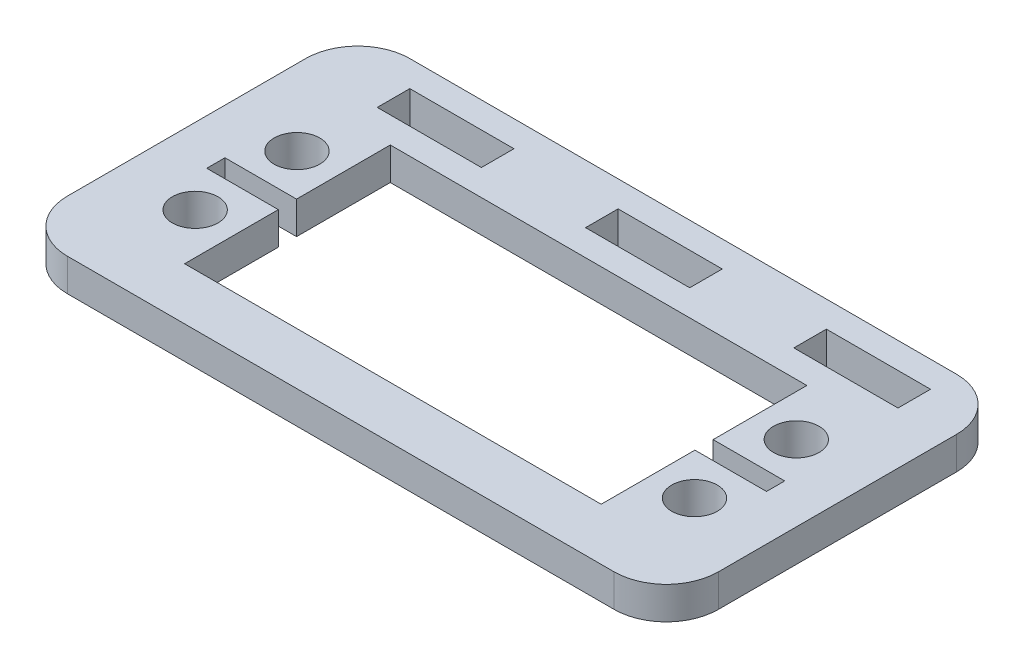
SolidWorks part; units mm, degrees
ref_plane "Front Plane" through (0, 0, 0) normal (0, 0, 1) x (1, 0, 0)
ref_plane "Top Plane" through (0, 0, 0) normal (0, 1, 0) x (1, 0, 0)
ref_plane "Right Plane" through (0, 0, 0) normal (1, 0, 0) x (0, 0, -1)
sketch "Sketch1" plane through (0, 0, 0) normal (0, 1, 0) x (1, 0, 0)
  line L0 (26.67, -10.033) -> (31.75, -10.033) construction
  line L1 (31.75, 18.288) -> (-31.75, 18.288)
  line L2 (31.75, 18.288) -> (31.75, -15.113)
  line L3 (31.75, -15.113) -> (-31.75, -15.113)
  line L4 (-31.75, 18.288) -> (-31.75, -15.113)
  line L5 (26.67, -10.033) -> (26.67, -15.113) construction
  line L6 (-26.67, -10.033) -> (-31.75, -10.033) construction
  line L7 (-26.67, 10.033) -> (26.67, 10.033) construction
  line L8 (-26.67, 10.033) -> (-26.67, -10.033) construction
  line L9 (-26.67, -10.033) -> (26.67, -10.033) construction
  line L10 (26.67, 10.033) -> (26.67, -10.033) construction
  line L11 (-26.67, 10.033) -> (26.67, -10.033) construction
  line L12 (-26.67, -10.033) -> (26.67, 10.033) construction
  line L13 (26.67, 15.748) -> (26.67, 18.288) construction
  line L14 (26.67, 15.748) -> (16.51, 15.748)
  line L15 (26.67, 15.748) -> (26.67, 12.573)
  line L16 (26.67, 12.573) -> (16.51, 12.573)
  line L17 (16.51, 15.748) -> (16.51, 12.573)
  line L18 (26.67, 15.748) -> (16.51, 12.573) construction
  line L19 (26.67, 12.573) -> (16.51, 15.748) construction
  line L20 (26.67, 12.573) -> (26.67, 10.033) construction
  line L21 (6.35, 15.748) -> (6.35, 12.573)
  line L22 (6.35, 15.748) -> (-3.81, 15.748)
  line L23 (6.35, 12.573) -> (-3.81, 12.573)
  line L24 (-3.81, 15.748) -> (-3.81, 12.573)
  line L25 (-13.97, 15.748) -> (-13.97, 12.573)
  line L26 (-13.97, 15.748) -> (-24.13, 15.748)
  line L27 (-13.97, 12.573) -> (-24.13, 12.573)
  line L28 (-24.13, 15.748) -> (-24.13, 12.573)
  line L30 (-20.32, -10.033) -> (20.32, -10.033)
  line L31 (-20.32, -10.033) -> (-20.32, 10.033)
  line L32 (-20.32, 10.033) -> (20.32, 10.033)
  line L33 (20.32, -10.033) -> (20.32, 10.033)
  line L34 (-20.32, -10.033) -> (20.32, 10.033) construction
  line L35 (-20.32, 10.033) -> (20.32, -10.033) construction
  point P0 (0, 0)
  point P4 (21.59, 14.1605)
  point P6 (0, 0)
  point P20 (0, 0)
  dimension "D1" = 20.066
  dimension "D2" = 53.34
  dimension "D3" = 5.08
  dimension "D4" = 3.175
  dimension "D5" = 10.16
  dimension "D6" = 2.54
  dimension "D7" = 3
  dimension "D8" = 6.35
extrude "Main Extrusion" add sketch "Sketch1" along normal blind 3.175
sketch "Sketch3" plane through (0, 3.175, 0) normal (0, 1, 0) x (1, 0, 0)
  line L0 (-26.0858, 6.3627) -> (-26.0858, 3.5687) construction
  line L1 (26.0858, -9.9949) -> (-26.0858, -9.9949) construction
  line L2 (26.0858, -9.9949) -> (26.0858, 9.9949) construction
  line L3 (26.0858, 9.9949) -> (-26.0858, 9.9949) construction
  line L5 (26.0858, -9.9949) -> (-26.0858, 9.9949) construction
  line L6 (26.0858, 9.9949) -> (-26.0858, -9.9949) construction
  line L7 (-26.0858, -3.5687) -> (-26.0858, -6.3627) construction
  line L8 (-26.0858, -6.3627) -> (-26.0858, -9.9949) construction
  line L9 (-26.0858, 6.3627) -> (-26.0858, 9.9949) construction
  line L10 (-24.3572, 4.9657) -> (-24.3572, -4.9657) construction
  line L14 (0, 9.9949) -> (0, -9.9949) construction
  circle A0 centre (-24.3572, 4.9657) radius 2.2225
  circle A1 centre (-24.3572, -4.9657) radius 2.2225
  circle A2 centre (24.3572, -4.9657) radius 2.2225
  circle A3 centre (24.3572, 4.9657) radius 2.2225
  point P0 (0, 0)
  dimension "D3" = 4.445
  dimension "D1" = 52.1716
  dimension "D2" = 19.9898
  dimension "D4" = 2.794
  dimension "D5" = 9.9314
extrude "Mounting Holes" cut sketch "Sketch3" against normal through all
sketch "Sketch5" plane through (0, 3.175, 0) normal (0, 1, 0) x (1, 0, 0)
  line L0 (-20.32, 0) -> (-20.32, 0.889)
  line L1 (-20.32, 10.033) -> (-20.32, -10.033) construction
  line L2 (-20.32, 0.889) -> (-27.305, 0.889)
  line L3 (-27.305, 0.889) -> (-27.305, -0.889)
  line L4 (-27.305, -0.889) -> (-20.32, -0.889)
  line L5 (-20.32, -0.889) -> (-20.32, 0)
  line L6 (0, 10.033) -> (0, -10.033) construction
  line L7 (20.32, 10.033) -> (-20.32, 10.033) construction
  line L8 (-20.32, -10.033) -> (20.32, -10.033) construction
  line L9 (27.305, -0.889) -> (20.32, -0.889)
  line L10 (27.305, 0.889) -> (27.305, -0.889)
  line L11 (20.32, 0.889) -> (27.305, 0.889)
  line L12 (20.32, -0.889) -> (20.32, 0)
  line L13 (20.32, 0) -> (20.32, 0.889)
  dimension "D1" = 6.985
  dimension "D2" = 1.778
extrude "Tab cutout" cut sketch "Sketch5" against normal through all
fillet "Fillet1" radius 5.08 4 edges at (31.75, 1.5875, -18.288) (31.75, 1.5875, 15.113) (-31.75, 1.5875, 15.113) (-31.75, 1.5875, -18.288)
sketch "Kerf Adjusted Sketch" plane through (0, 3.175, 0) normal (0, 1, 0) x (1, 0, 0)
  line L20 (-24.0538, 15.6718) -> (-24.0538, 12.6492)
  line L21 (-14.0462, 15.6718) -> (-24.0538, 15.6718)
  line L22 (-14.0462, 12.6492) -> (-14.0462, 15.6718)
  line L23 (-24.0538, 12.6492) -> (-14.0462, 12.6492)
  line L24 (-24.0538, 15.6718) -> (-24.0538, 12.6492)
  line L25 (-14.0462, 15.6718) -> (-24.0538, 15.6718)
  line L26 (-14.0462, 12.6492) -> (-14.0462, 15.6718)
  line L27 (-24.0538, 12.6492) -> (-14.0462, 12.6492)
  line L32 (-3.7338, 15.6718) -> (-3.7338, 12.6492)
  line L33 (6.2738, 15.6718) -> (-3.7338, 15.6718)
  line L34 (6.2738, 12.6492) -> (6.2738, 15.6718)
  line L35 (-3.7338, 12.6492) -> (6.2738, 12.6492)
  line L36 (-3.7338, 15.6718) -> (-3.7338, 12.6492)
  line L37 (6.2738, 15.6718) -> (-3.7338, 15.6718)
  line L38 (6.2738, 12.6492) -> (6.2738, 15.6718)
  line L39 (-3.7338, 12.6492) -> (6.2738, 12.6492)
  line L44 (26.5938, 12.6492) -> (26.5938, 15.6718)
  line L45 (26.5938, 15.6718) -> (16.5862, 15.6718)
  line L46 (16.5862, 15.6718) -> (16.5862, 12.6492)
  line L47 (16.5862, 12.6492) -> (26.5938, 12.6492)
  line L48 (26.5938, 12.6492) -> (26.5938, 15.6718)
  line L49 (26.5938, 15.6718) -> (16.5862, 15.6718)
  line L50 (16.5862, 15.6718) -> (16.5862, 12.6492)
  line L51 (16.5862, 12.6492) -> (26.5938, 12.6492)
  line L126 (31.8262, -10.033) -> (31.8262, 13.208)
  line L127 (-26.67, -15.1892) -> (26.67, -15.1892)
  line L128 (-31.8262, 13.208) -> (-31.8262, -10.033)
  line L129 (26.67, 18.3642) -> (-26.67, 18.3642)
  line L130 (27.2288, -0.8128) -> (27.2288, 0.8128)
  line L131 (20.2438, 0.8128) -> (20.2438, 9.9568)
  line L132 (27.2288, 0.8128) -> (20.2438, 0.8128)
  line L133 (20.2438, -0.8128) -> (27.2288, -0.8128)
  line L134 (20.2438, -9.9568) -> (20.2438, -0.8128)
  line L135 (-20.2438, -9.9568) -> (20.2438, -9.9568)
  line L136 (-20.2438, -0.8128) -> (-20.2438, -9.9568)
  line L137 (-27.2288, 0.8128) -> (-27.2288, -0.8128)
  line L138 (-27.2288, -0.8128) -> (-20.2438, -0.8128)
  line L139 (-20.2438, 0.8128) -> (-27.2288, 0.8128)
  line L140 (-20.2438, 9.9568) -> (-20.2438, 0.8128)
  line L141 (20.2438, 9.9568) -> (-20.2438, 9.9568)
  line L142 (27.2288, -0.8128) -> (27.2288, 0.8128)
  line L143 (20.2438, 0.8128) -> (20.2438, 9.9568)
  line L144 (27.2288, 0.8128) -> (20.2438, 0.8128)
  line L145 (20.2438, -0.8128) -> (27.2288, -0.8128)
  line L146 (20.2438, -9.9568) -> (20.2438, -0.8128)
  line L147 (-20.2438, -9.9568) -> (20.2438, -9.9568)
  line L148 (-20.2438, -0.8128) -> (-20.2438, -9.9568)
  line L149 (-27.2288, 0.8128) -> (-27.2288, -0.8128)
  line L150 (-27.2288, -0.8128) -> (-20.2438, -0.8128)
  line L151 (-20.2438, 0.8128) -> (-27.2288, 0.8128)
  line L152 (-20.2438, 9.9568) -> (-20.2438, 0.8128)
  line L153 (20.2438, 9.9568) -> (-20.2438, 9.9568)
  line L154 (31.8262, -10.033) -> (31.8262, 13.208)
  line L155 (-26.67, -15.1892) -> (26.67, -15.1892)
  line L156 (-31.8262, 13.208) -> (-31.8262, -10.033)
  line L157 (26.67, 18.3642) -> (-26.67, 18.3642)
  circle A18 centre (-24.3572, 4.9657) radius 2.1463
  circle A19 centre (-24.3572, 4.9657) radius 2.1463
  circle A21 centre (-24.3572, -4.9657) radius 2.1463
  circle A22 centre (-24.3572, -4.9657) radius 2.1463
  circle A24 centre (24.3572, -4.9657) radius 2.1463
  circle A25 centre (24.3572, -4.9657) radius 2.1463
  circle A27 centre (24.3572, 4.9657) radius 2.1463
  circle A28 centre (24.3572, 4.9657) radius 2.1463
  arc A37 (26.67, -15.1892) -> (31.8262, -10.033) centre (26.67, -10.033) ccw
  arc A38 (-31.8262, -10.033) -> (-26.67, -15.1892) centre (-26.67, -10.033) ccw
  arc A39 (-26.67, 18.3642) -> (-31.8262, 13.208) centre (-26.67, 13.208) ccw
  arc A40 (31.8262, 13.208) -> (26.67, 18.3642) centre (26.67, 13.208) ccw
  arc A41 (26.67, -15.1892) -> (31.8262, -10.033) centre (26.67, -10.033) ccw
  arc A42 (-31.8262, -10.033) -> (-26.67, -15.1892) centre (-26.67, -10.033) ccw
  arc A43 (-26.67, 18.3642) -> (-31.8262, 13.208) centre (-26.67, 13.208) ccw
  arc A44 (31.8262, 13.208) -> (26.67, 18.3642) centre (26.67, 13.208) ccw
  dimension "D1" = 0.0762
  dimension "D2" = 0.0762
  dimension "D3" = 0.0762
  dimension "D4" = 0.0762
  dimension "D5" = 0.0762
  dimension "D6" = 0.0762
  dimension "D7" = 0.0762
  dimension "D8" = 0.0762
  dimension "D9" = 0.0762
